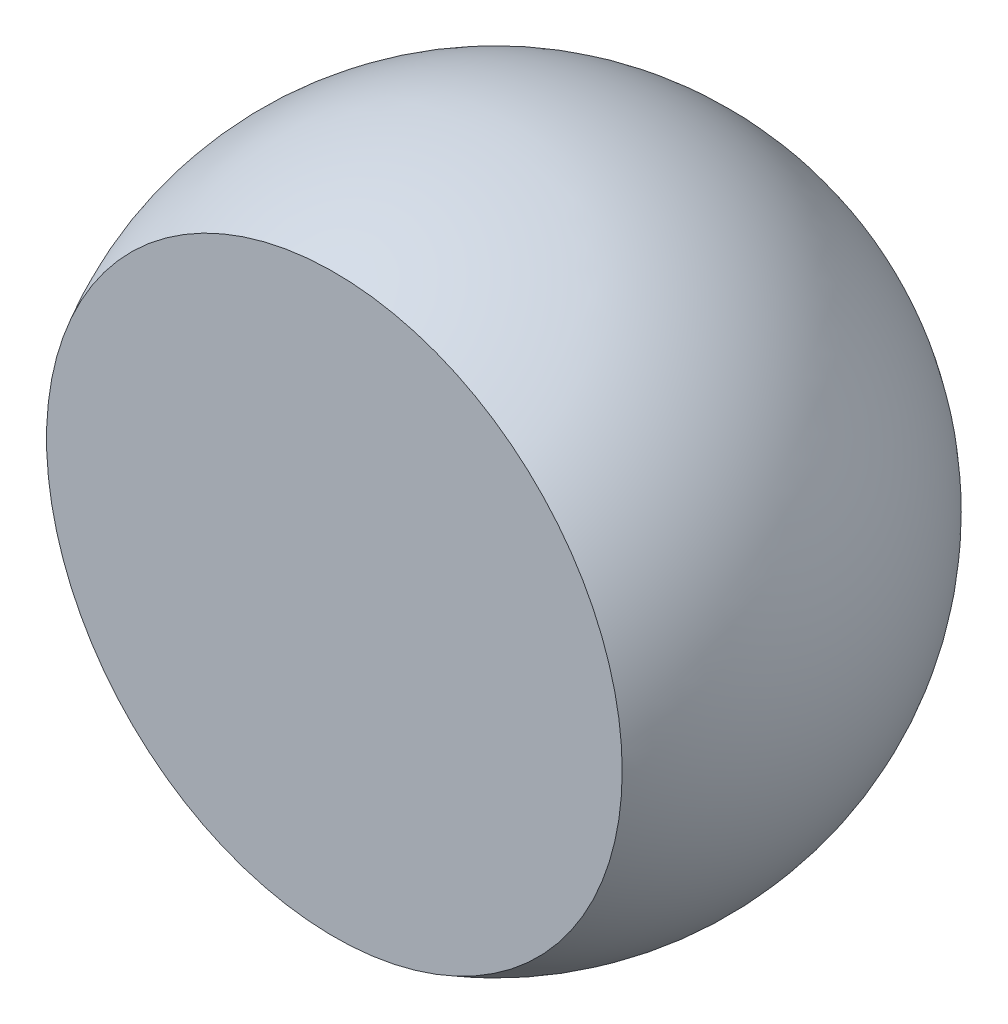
SolidWorks part; units mm, degrees
ref_plane "前视基准面" through (0, 0, 0) normal (0, 0, 1) x (1, 0, 0)
ref_plane "上视基准面" through (0, 0, 0) normal (0, 1, 0) x (1, 0, 0)
ref_plane "右视基准面" through (0, 0, 0) normal (1, 0, 0) x (0, 0, -1)
other "Configuration Table"
sketch "草图1" plane through (0, 0, 0) normal (0, 1, 0) x (1, 0, 0)
  line L0 (-50, 0) -> (50, 0) construction
  line L1 (-50, 0) -> (50, 0)
  arc A0 (50, 0) -> (-50, 0) centre (0, 0) ccw
revolve "旋转3" add sketch "草图1" angle 360 about L0
sketch "草图2" plane through (0, 0, 0) normal (0, 1, 0) x (1, 0, 0)
  line L0 (-43.6578, -24.3721) -> (43.6578, -24.3721)
  circle A1 centre (0, 0) radius 50 construction
  arc A2 (-43.6578, -24.3721) -> (43.6578, -24.3721) centre (0, 0) ccw
extrude "切除-拉伸1" cut sketch "草图2" along normal through all and the other way through all
